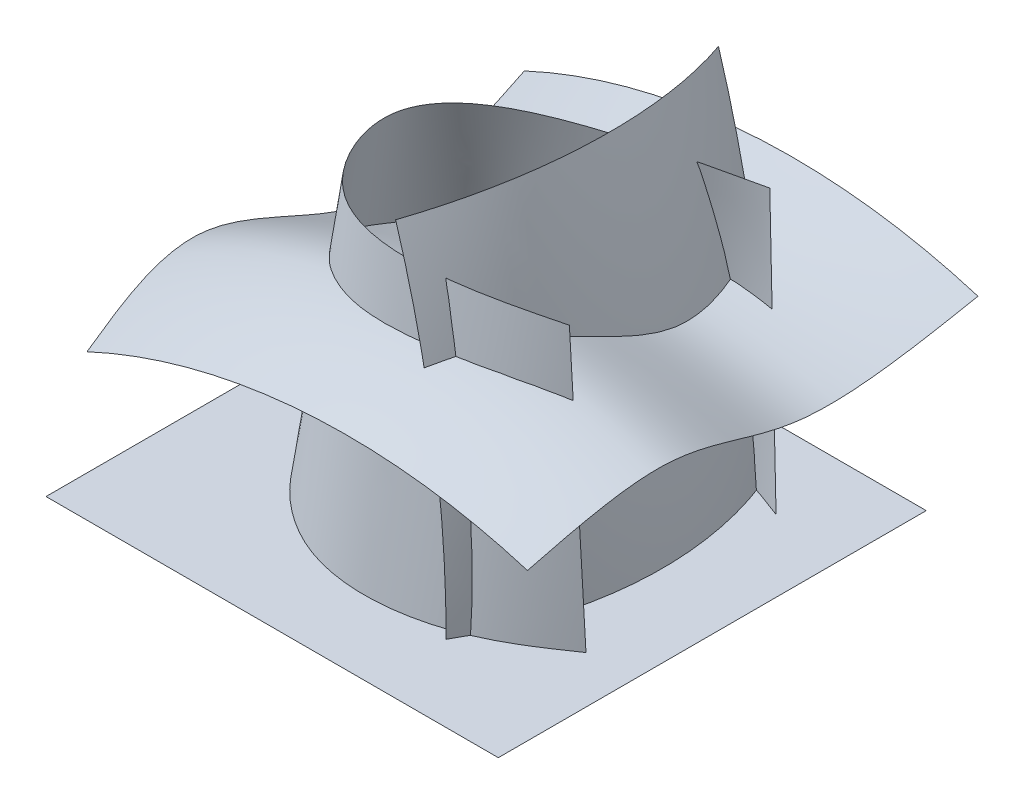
SolidWorks part; units mm, degrees
ref_plane "Front Plane" through (0, 0, 0) normal (0, 0, 1) x (1, 0, 0)
ref_plane "Top Plane" through (0, 0, 0) normal (0, 1, 0) x (1, 0, 0)
ref_plane "Right Plane" through (0, 0, 0) normal (1, 0, 0) x (0, 0, -1)
ref_plane "Plane1" through (0, 101.6, 0) normal (0, 1, 0) x (-1, 0, 0)
sketch "Sketch1" plane through (0, 101.6, 0) normal (0, 1, 0) x (-1, 0, 0)
  spline S0 degree 3 poles (-31.2426, -37.2508) (-17.7822, -34.2859) (13.0085, -27.5037) (68.8642, -6.0237) (45.4663, 46.7928) (1.3586, 49.6205) (-25.4985, 42.779) (-37.7658, 39.6541) knots 0 0 0 0 0.200606 0.458885 0.613831 0.823613 1 1 1 1
sketch "Sketch2" plane through (0, 0, 0) normal (0, 1, 0) x (1, 0, 0)
  spline S0 degree 3 poles (30.0174, 40.6793) (21.3908, 43.9849) (-2.8997, 53.2923) (-34.5069, 39.2614) (-70.516, 40.3084) (-84.6199, 8.4065) (-75.4952, -28.4035) (-37.6126, -60.8324) (8.9967, -55.117) (31.3673, -39.705) (38.6387, -34.6955) knots 0 0 0 0 0.092916 0.261628 0.342227 0.434788 0.567616 0.718065 0.908359 1 1 1 1
surface "Surface-Loft1"
sketch "Sketch3" plane through (0, 0, 0) normal (0, 1, 0) x (1, 0, 0)
  line L0 (-396.0118, 25.6376) -> (-396.0118, -17.4983) construction
  arc A0 (15.9632, 52.5051) -> (10.0474, -55.2113) centre (-89.6097, 4.2825) cw
surface "Surface-Revolve1" sketch "Sketch3" parameters "D1"=17
sketch "Sketch4" plane through (0, 0, 0) normal (1, 0, 0) x (0, 0, -1)
  line L0 (-34.2313, -147.059) -> (37.3031, -147.059) construction
  spline S0 degree 3 poles (-79.8663, 69.3131) (-64.5873, 75.896) (-32.7282, 89.6222) (17.8864, 57.189) (55.7014, 69.1958) (76.4646, 75.7884) knots 0 0 0 0 0.293554 0.612109 1 1 1 1
surface "Surface-Revolve2" sketch "Sketch4" parameters "D1"=17, "D2"=25
sketch "Sketch5" plane through (0, 0, 0) normal (0, 1, 0) x (-1, 0, 0)
  line L1 (-55.2226, 82.0682) -> (103.6336, 82.0682)
  line L2 (-55.2226, 82.0682) -> (-55.2226, -68.224)
  line L3 (-55.2226, -68.224) -> (103.6336, -68.224)
  line L4 (103.6336, 82.0682) -> (103.6336, -68.224)
surface "Surface-Plane1" sketch "Sketch5"
